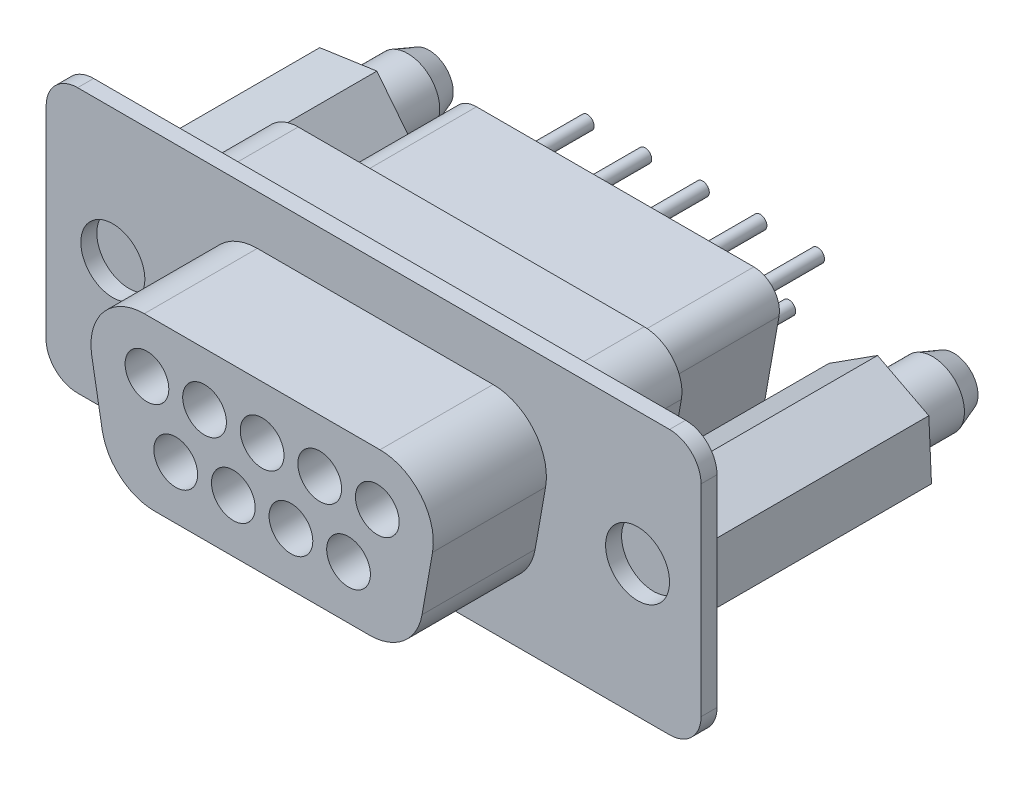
SolidWorks part; units mm, degrees
ref_plane "Front" through (0, 0, 0) normal (0, 0, 1) x (1, 0, 0)
ref_plane "Top" through (0, 0, 0) normal (0, 1, 0) x (1, 0, 0)
ref_plane "Right" through (0, 0, 0) normal (1, 0, 0) x (0, 0, -1)
sketch "Sketch1" plane through (0, 0, 0) normal (0, 0, 1) x (1, 0, 0)
  line L0 (8.1148, -0.4538) -> (7.6177, -3.2732)
  line L1 (5.6134, 2.5273) -> (-5.6134, 2.5273)
  line L2 (0, 2.5273) -> (0, 0) construction
  line L3 (0, 0) -> (1.3716, -2.8448) construction
  line L4 (-8.1148, -0.4538) -> (-7.6177, -3.2732)
  line L5 (0.6858, -1.4224) -> (7.944, -1.4224) construction
  line L8 (-5.1163, -5.3721) -> (5.1163, -5.3721)
  arc A0 (5.6134, 2.5273) -> (8.1148, -0.4538) centre (5.6134, -0.0127) cw
  arc A3 (7.6177, -3.2732) -> (5.1163, -5.3721) centre (5.1163, -2.8321) cw
  arc A5 (-5.6134, 2.5273) -> (-8.1148, -0.4538) centre (-5.6134, -0.0127) ccw
  arc A6 (-7.6177, -3.2732) -> (-5.1163, -5.3721) centre (-5.1163, -2.8321) ccw
  circle A7 centre (5.4864, 0) radius 1.0414
  circle A9 centre (2.7432, 0) radius 1.0414
  circle A10 centre (0, 0) radius 1.0414
  circle A12 centre (-2.7432, 0) radius 1.0414
  circle A13 centre (-5.4864, 0) radius 1.0414
  circle A14 centre (-4.1148, -2.8448) radius 1.0414
  circle A15 centre (-1.3716, -2.8448) radius 1.0414
  circle A16 centre (1.3716, -2.8448) radius 1.0414
  circle A17 centre (4.1148, -2.8448) radius 1.0414
  dimension "D1" = 80
  dimension "D2" = 1.3716
  dimension "D3" = 2.7432
  dimension "D4" = 2.7432
  dimension "D5" = 2.7432
  dimension "D6" = 2.7432
  dimension "D7" = 2.7432
  dimension "D8" = 2.7432
  dimension "D9" = 2.7432
  dimension "D10" = 3.9497
  dimension "D11" = 2.54
  dimension "D12" = 2.54
  dimension "D13" = 2.0828
  dimension "D17" = 11.2268
  dimension "D18" = 10.2325
  dimension "D19" = 2.8448
  dimension "D20" = 16.3068
  dimension "D14" = 80
  dimension "D15" = 7.8994
extrude "Base-Extrude" add sketch "Sketch1" along normal blind 6.1468
sketch "Sketch2" plane through (7.9689, 1.5882, 0) normal (0, 0, -1) x (-1, 0, 0)
  line L0 (23.6407, 1.79) -> (23.6407, -7.6588)
  line L1 (22.1421, 3.2886) -> (-6.0519, 3.2886)
  line L2 (6.5973, -4.433) -> (9.3405, -4.433) construction
  line L3 (22.1498, -9.3098) -> (-6.0519, -9.3098)
  line L4 (7.9689, -4.433) -> (7.9689, -1.5882) construction
  line L5 (-7.5505, 1.79) -> (-7.5505, -7.8112)
  line L6 (7.9689, -3.0106) -> (20.4657, -3.0106) construction
  arc A0 (22.1421, 3.2886) -> (23.6407, 1.79) centre (22.1421, 1.79) cw
  arc A2 (23.6407, -7.6588) -> (22.1498, -9.3098) centre (22.1498, -7.8112) cw
  circle A4 centre (2.4825, -1.5882) radius 1.0414 construction
  arc A5 (-6.0519, 3.2886) -> (-7.5505, 1.79) centre (-6.0519, 1.79) ccw
  arc A6 (-6.0519, -9.3098) -> (-7.5505, -7.8112) centre (-6.0519, -7.8112) cw
  circle A8 centre (13.4553, -1.5882) radius 1.0414 construction
  circle A9 centre (20.4657, -3.0106) radius 1.524
  circle A10 centre (-4.5279, -3.0106) radius 1.524
  dimension "D5" = 10.033
  dimension "D6" = 4.8768
  dimension "D8" = 6.2992
  dimension "D9" = 3.0226
  dimension "D10" = 3.048
  dimension "D11" = 24.9936
  dimension "D12" = 12.4968
  dimension "D2" = 9.4488
  dimension "D3" = 12.5984
  dimension "D4" = 31.1912
  dimension "D7" = 3.175
extrude "Boss-Extrude1" add sketch "Sketch2" against normal blind 0.762
sketch "Sketch3" plane through (4.149, -0.2484, 0) normal (0, 0, -1) x (-1, 0, 0)
  line L0 (-4.0901, 4.1854) -> (12.3881, 4.1854)
  line L1 (4.149, 0.2484) -> (4.149, 4.1854) construction
  line L2 (14.159, 2.0749) -> (12.9222, -4.9396)
  line L3 (10.9986, -6.5537) -> (-2.7007, -6.5537)
  line L7 (-4.6242, -4.9396) -> (-5.8611, 2.0749)
  arc A0 (12.3881, 4.1854) -> (14.159, 2.0749) centre (12.3881, 2.3871) cw
  circle A1 centre (9.6354, 0.2484) radius 1.0414 construction
  arc A2 (12.9222, -4.9396) -> (10.9986, -6.5537) centre (10.9986, -4.6004) cw
  circle A4 centre (0.0342, -2.5964) radius 1.0414 construction
  arc A5 (-2.7007, -6.5537) -> (-4.6242, -4.9396) centre (-2.7007, -4.6004) cw
  circle A6 centre (-1.3374, 0.2484) radius 1.0414 construction
  arc A7 (-5.8611, 2.0749) -> (-4.0901, 4.1854) centre (-4.0901, 2.3871) cw
  dimension "D1" = 1.3895
  dimension "D2" = 80
  dimension "D4" = 1.9533
  dimension "D7" = 3.937
  dimension "D8" = 2.7348
  dimension "D9" = 2.7527
  dimension "D3" = 10.7391
  dimension "D10" = 80
extrude "Boss-Extrude2" add sketch "Sketch3" along normal blind 3.81
sketch "Sketch6" plane through (15.474, -0.0678, -3.81) normal (0, 0, -1) x (-1, 0, 0)
  line L0 (23.2787, 0.7959) -> (22.4456, -3.9285)
  line L1 (22.078, 2.2268) -> (8.87, 2.2268)
  line L3 (21.245, -4.936) -> (9.7082, -4.936)
  line L4 (7.6695, 0.7946) -> (8.5077, -3.9298)
  arc A0 (22.078, 2.2268) -> (23.2787, 0.7959) centre (22.078, 1.0076) cw
  circle A1 centre (20.9604, 0.0678) radius 1.0414 construction
  arc A2 (22.4456, -3.9285) -> (21.245, -4.936) centre (21.245, -3.7168) cw
  arc A4 (9.7082, -4.936) -> (8.5077, -3.9298) centre (9.7082, -3.7168) cw
  circle A5 centre (11.3592, -2.777) radius 1.0414 construction
  arc A6 (8.87, 2.2268) -> (7.6695, 0.7946) centre (8.87, 1.0076) ccw
  dimension "D1" = 13.208
  dimension "D2" = 7.1628
  dimension "D3" = 1.2192
  dimension "D4" = 1.2192
  dimension "D6" = 1.1176
  dimension "D7" = 2.159
  dimension "D8" = 1.651
  dimension "D5" = 80
extrude "Boss-Extrude3" add sketch "Sketch6" along normal blind 6.858
sketch "Sketch7" plane through (0, 0, -10.668) normal (0, 0, -1) x (-1, 0, 0)
  circle A0 centre (5.4864, 0) radius 0.3175
  circle A1 centre (2.7432, 0) radius 0.3175
  circle A2 centre (0, 0) radius 0.3175
  circle A4 centre (-2.7432, 0) radius 0.3175
  circle A5 centre (-5.4864, 0) radius 0.3175
  circle A6 centre (-4.1148, -2.8448) radius 0.3175
  circle A7 centre (-1.3716, -2.8448) radius 0.3175
  circle A8 centre (1.3716, -2.8448) radius 0.3175
  circle A9 centre (4.1148, -2.8448) radius 0.3175
  circle A10 centre (5.4864, 0) radius 1.0414 construction
  circle A11 centre (2.7432, 0) radius 1.0414 construction
  circle A12 centre (0, 0) radius 1.0414 construction
  circle A13 centre (-2.7432, 0) radius 1.0414 construction
  circle A14 centre (-5.4864, 0) radius 1.0414 construction
  circle A15 centre (-4.1148, -2.8448) radius 1.0414 construction
  circle A16 centre (-1.3716, -2.8448) radius 1.0414 construction
  circle A17 centre (1.3716, -2.8448) radius 1.0414 construction
  circle A18 centre (4.1148, -2.8448) radius 1.0414 construction
  dimension "D1" = 0.635
extrude "Boss-Extrude4" add sketch "Sketch7" along normal blind 4.1656
sketch "Sketch8" plane through (0, 0, 0) normal (0, 0, -1) x (-1, 0, 0)
  line L1 (13.5167, -3.9759) -> (15.2181, -1.8158)
  line L2 (15.2181, -1.8158) -> (14.1982, 0.7376)
  line L3 (14.1982, 0.7376) -> (11.4769, 1.1311)
  line L4 (11.4769, 1.1311) -> (9.7755, -1.029)
  line L5 (9.7755, -1.029) -> (10.7954, -3.5824)
  line L6 (10.7954, -3.5824) -> (13.5167, -3.9759)
  line L7 (-12.6237, -4.1691) -> (-10.1815, -2.9056)
  line L8 (-10.1815, -2.9056) -> (-10.0546, -0.1589)
  line L9 (-10.0546, -0.1589) -> (-12.3699, 1.3243)
  line L10 (-12.3699, 1.3243) -> (-14.8121, 0.0608)
  line L11 (-14.8121, 0.0608) -> (-14.939, -2.6859)
  line L12 (-14.939, -2.6859) -> (-12.6237, -4.1691)
  circle A0 centre (12.4968, -1.4224) radius 2.3813 construction
  circle A1 centre (-12.4968, -1.4224) radius 2.3813 construction
  dimension "D1" = 4.7625
extrude "Boss-Extrude5" add sketch "Sketch8" along normal blind 10.795
sketch "Sketch9" plane through (0, 0, -10.795) normal (0, 0, -1) x (-1, 0, 0)
  circle A0 centre (12.4968, -1.4224) radius 1.524
  circle A1 centre (-12.4968, -1.4224) radius 1.524
  dimension "D1" = 3.048
extrude "Boss-Extrude6" add sketch "Sketch9" along normal blind 3.5052
chamfer "Chamfer1" distance 1.016 angle 20 2 edges at (-14.0208, -1.4224, -14.3002) (10.9728, -1.4224, -14.3002)
